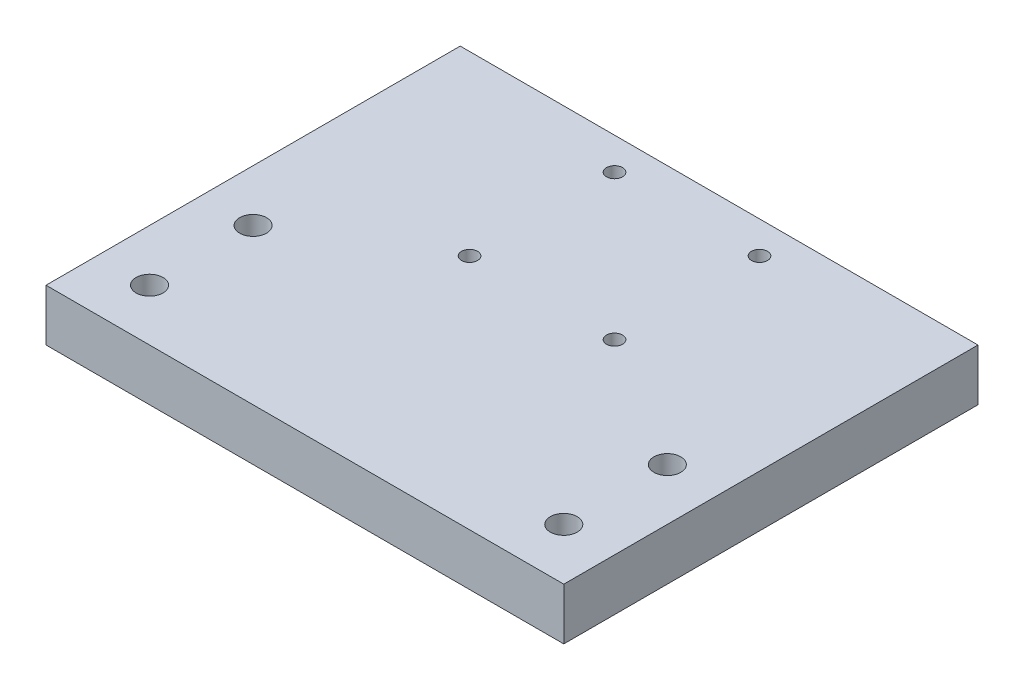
SolidWorks part; units mm, degrees
ref_plane "前视基准面" through (0, 0, 0) normal (0, 0, 1) x (1, 0, 0)
ref_plane "上视基准面" through (0, 0, 0) normal (0, 1, 0) x (1, 0, 0)
ref_plane "右视基准面" through (0, 0, 0) normal (1, 0, 0) x (0, 0, -1)
other "Configuration Table"
sketch "草图1" plane through (0, 0, 0) normal (0, 1, 0) x (1, 0, 0)
  line L1 (-50, 40) -> (50, 40)
  line L2 (-50, 40) -> (-50, -40)
  line L3 (-50, -40) -> (50, -40)
  line L4 (50, 40) -> (50, -40)
  line L5 (-50, 40) -> (50, -40) construction
  line L6 (-50, -40) -> (50, 40) construction
  point P0 (0, 0)
  dimension "D1" = 80
  dimension "D2" = 100
extrude "凸台-拉伸1" add sketch "草图1" along normal blind 10
sketch "草图3" plane through (0, 0, 0) normal (0, -1, 0) x (1, 0, 0)
  circle A0 centre (40, 30) radius 2.6
  circle A1 centre (40, 10) radius 2.6
  circle A2 centre (-40, 30) radius 2.6
  circle A3 centre (-40, 10) radius 2.6
  dimension "D1" = 5.2
  dimension "D2" = 5.2
  dimension "D3" = 5.2
  dimension "D4" = 5.2
extrude "切除-拉伸2" cut sketch "草图3" against normal through all
sketch "草图4" plane through (0, 10, 0) normal (0, 1, 0) x (1, 0, 0)
  circle A0 centre (14, 33.8) radius 1.55
  circle A1 centre (14, 5.8) radius 1.55
  circle A2 centre (-14, 33.8) radius 1.55
  circle A3 centre (-14, 5.8) radius 1.55
  dimension "D1" = 3.1
  dimension "D2" = 3.1
  dimension "D3" = 3.1
  dimension "D4" = 3.1
extrude "切除-拉伸3" cut sketch "草图4" against normal through all
